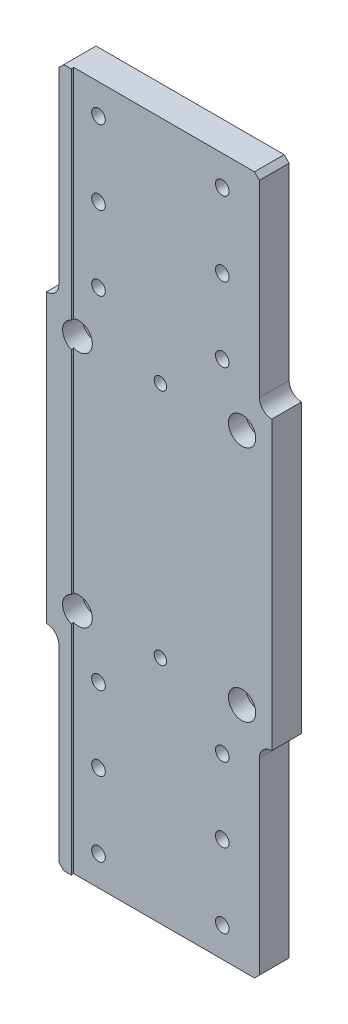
SolidWorks part; units mm, degrees
ref_plane "정면" through (0, 0, 0) normal (0, 0, 1) x (1, 0, 0)
ref_plane "윗면" through (0, 0, 0) normal (0, 1, 0) x (1, 0, 0)
ref_plane "우측면" through (0, 0, 0) normal (1, 0, 0) x (0, 0, -1)
sketch "스케치1" plane through (0, 0, 0) normal (0, 0, 1) x (1, 0, 0)
  line L1 (-45, 58) -> (45, 58)
  line L2 (-45, 58) -> (-45, -58)
  line L3 (-45, -58) -> (45, -58)
  line L4 (45, 58) -> (45, -58)
  line L5 (-45, 58) -> (45, -58) construction
  line L6 (-45, -58) -> (45, 58) construction
  line L7 (-40, 141) -> (40, 141)
  line L8 (-40, 141) -> (-40, -141)
  line L9 (-40, -141) -> (40, -141)
  line L10 (40, 141) -> (40, -141)
  line L11 (-40, 141) -> (40, -141) construction
  line L12 (-40, -141) -> (40, 141) construction
  point P0 (0, 0)
  point P6 (0, 0)
  dimension "D1" = 80
  dimension "D2" = 5
  dimension "D3" = 116
  dimension "D4" = 83
extrude "보스-돌출2" add sketch "스케치1" along normal mid plane 13 contours L10 L7 L8 L1 | L10 L3 L8 L9
sketch "스케치2" plane through (0, 0, 6.5) normal (0, 0, 1) x (1, 0, 0)
  line L6 (-40, 141) -> (40, 141) construction
  line L7 (-35, 141) -> (45, 141)
  line L8 (-35, 141) -> (-35, -141)
  line L9 (-35, -141) -> (45, -141)
  line L10 (45, 141) -> (45, -141)
  line L11 (45, 58) -> (45, -58) construction
  line L12 (-40, -141) -> (40, -141) construction
  line L14 (-45, 58) -> (-45, -58) construction
  dimension "D1" = 10
extrude "컷-돌출1" cut sketch "스케치2" against normal blind 1
hole_wizard "M6 소켓 머리 캡 나사용 카운터보어1" positions "스케치3" profile "스케치4" counterbore size "M6" standard "KS"
sketch "스케치3" plane through (0, 0, 6.5) normal (0, 0, 1) x (1, 0, 0)
  line L0 (40, 141) -> (-35, 141) construction
  line L1 (-45, 58) -> (-45, -58) construction
  point P0 (-33, 48)
  point P2 (33, 48)
  point P4 (-33, -48)
  point P6 (33, -48)
  dimension "D1" = 96
  dimension "D2" = 93
  dimension "D3" = 66
  dimension "D4" = 12
sketch "스케치4" plane through (-33, 48, 6.5) normal (1, 0, 0) x (0, -1, 0)
  line L0 (0, 0) -> (0, 13)
  line L1 (0, 13) -> (3.3, 13)
  line L3 (3.3, 13) -> (3.3, 8)
  line L4 (3.3, 8) -> (5.5, 8)
  line L5 (5.5, 8) -> (5.5, 0)
  line L7 (5.5, 0) -> (0, 0)
  line L11 (0, -6.35) -> (0, 107.95) construction
  dimension "관통 구멍 지름" = 6.6
  dimension "관통 구멍 깊이" = 13
  dimension "카운터보어 지름" = 11
  dimension "카운터보어 깊이" = 8
hole_wizard "M5 소켓 머리 캡 나사용 카운터보어1" positions "스케치9" profile "스케치10" counterbore size "M5" standard "KS"
sketch "스케치9" plane through (0, 0, -6.5) normal (0, 0, -1) x (-1, 0, 0)
  line L0 (40, 141) -> (40, 58) construction
  line L1 (40, 141) -> (-40, 141) construction
  point P0 (-25, 129)
  point P2 (25, 129)
  point P4 (-25, 99)
  point P6 (25, 99)
  point P8 (-25, 69)
  point P10 (25, 69)
  dimension "D1" = 50
  dimension "D2" = 15
  dimension "D3" = 12
  dimension "D4" = 30
  dimension "D5" = 30
sketch "스케치10" plane through (25, 129, -6.5) normal (1, 0, 0) x (0, 1, 0)
  line L0 (0, 0) -> (0, 13)
  line L1 (0, 13) -> (2.75, 13)
  line L3 (2.75, 13) -> (2.75, 7)
  line L4 (2.75, 7) -> (4.75, 7)
  line L5 (4.75, 7) -> (4.75, 0)
  line L7 (4.75, 0) -> (0, 0)
  line L11 (0, -6.35) -> (0, 107.95) construction
  dimension "관통 구멍 지름" = 5.5
  dimension "관통 구멍 깊이" = 13
  dimension "카운터보어 지름" = 9.5
  dimension "카운터보어 깊이" = 7
pattern_linear "선형 패턴1" count 2 spacing 198 along (0, -1, 0) of "M5 소켓 머리 캡 나사용 카운터보어1"
hole_wizard "Ø5.0mm 맞춤핀 구멍1" positions "스케치11" profile "스케치12" hole size "Ø5.0" standard "ISO"
sketch "스케치11" plane through (0, 0, 5.5) normal (0, 0, 1) x (1, 0, 0)
  line L0 (0, 0) -> (0, 105.7513) construction
  line L2 (0, 0) -> (76.0941, 0) construction
  line L4 (40, 141) -> (-35, 141) construction
  point P0 (0, 48)
  point P2 (0, -48)
  dimension "D1" = 96
  dimension "D2" = 93
sketch "스케치12" plane through (0, 48, 5.5) normal (1, 0, 0) x (0, -1, 0)
  line L0 (0, 0) -> (0, 12)
  line L1 (0, 12) -> (2.5, 12)
  line L2 (2.5, 12) -> (2.5, 0)
  line L5 (2.5, 0) -> (0, 0)
  line L11 (0, -6.35) -> (0, 107.95) construction
  dimension "관통 구멍 지름" = 5
  dimension "관통 구멍 깊이" = 12
fillet "필렛1" radius 5 4 edges at (-40, -58, 0) (-40, 58, 0) (40, -58, -0.5) (40, 58, -0.5)
chamfer "모따기1" distance 2 angle 45 4 edges at (40, -141, -0.5) (-40, -141, 0) (-40, 141, 0) (40, 141, -0.5)
